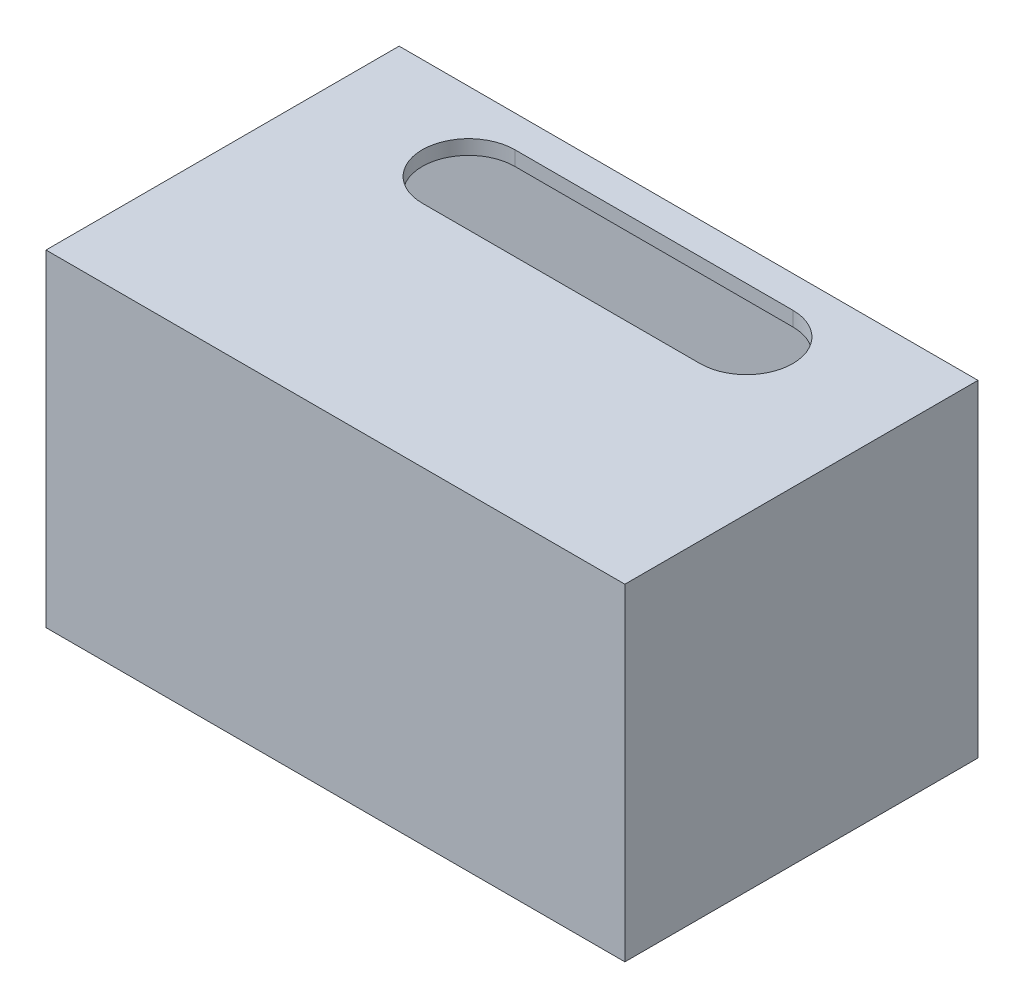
SolidWorks part; units mm, degrees
ref_plane "Front Plane" through (0, 0, 0) normal (0, 0, 1) x (1, 0, 0)
ref_plane "Top Plane" through (0, 0, 0) normal (0, 1, 0) x (1, 0, 0)
ref_plane "Right Plane" through (0, 0, 0) normal (1, 0, 0) x (0, 0, -1)
sketch "Sketch1" plane through (0, 0, 0) normal (0, 1, 0) x (1, 0, 0)
  line L1 (0, 0) -> (63.5, 0)
  line L2 (0, 0) -> (0, 38.735)
  line L3 (0, 38.735) -> (63.5, 38.735)
  line L4 (63.5, 0) -> (63.5, 38.735)
  dimension "D1" = 38.735
  dimension "D2" = 63.5
extrude "Extrude1" add sketch "Sketch1" along normal blind 4.7625
sketch "Sketch2" plane through (0, 4.7625, 0) normal (0, 1, 0) x (1, 0, 0)
  line L1 (0, 38.735) -> (63.5, 38.735)
  line L2 (0, 38.735) -> (0, 0)
  line L3 (0, 0) -> (63.5, 0)
  line L4 (63.5, 38.735) -> (63.5, 0)
extrude "Extrude-Thin1" add sketch "Sketch2" along normal blind 29.5275 thin
sketch "Sketch3" plane through (0, 34.29, 0) normal (0, 1, 0) x (1, 0, 0)
  line L1 (63.5, 38.735) -> (0, 38.735)
  line L2 (63.5, 38.735) -> (63.5, 0)
  line L3 (63.5, 0) -> (0, 0)
  line L4 (0, 38.735) -> (0, 0)
  line L5 (16.1925, 35.2425) -> (46.6725, 35.2425)
  line L6 (46.6725, 25.0825) -> (16.1925, 25.0825)
  line L7 (61.9125, 1.5875) -> (61.9125, 37.1475) construction
  line L8 (61.9125, 37.1475) -> (1.5875, 37.1475) construction
  arc A0 (46.6725, 25.0825) -> (46.6725, 35.2425) centre (46.6725, 30.1625) ccw
  arc A1 (16.1925, 35.2425) -> (16.1925, 25.0825) centre (16.1925, 30.1625) ccw
  point P16 (51.7525, 30.1625)
  point P17 (11.1125, 30.1625)
  dimension "D1" = 10.16
  dimension "D2" = 1.905
  dimension "D3" = 40.64
  dimension "D4" = 10.16
extrude "Extrude2" add sketch "Sketch3" along normal blind 1.5875
hole_wizard "#8-32 Tapped Hole1" positions "Sketch5" profile "Sketch4" tap size "#8-32" standard "Ansi Inch"
sketch "Sketch5" plane through (0, 0, 0) normal (-1, 0, 0) x (0, 0, 1)
  line L2 (3.5746, 4.7625) -> (-36.0144, 4.7625) construction
  line L4 (-38.735, 0) -> (0, 0) construction
  line L5 (-29.21, 2.3812) -> (-29.21, 4.7625) construction
  line L10 (-29.21, 2.3812) -> (-29.21, 0) construction
  line L17 (-38.735, 35.8775) -> (-38.735, 0) construction
  point P0 (-29.21, 2.3812)
  dimension "D1" = 4.7625
  dimension "D2" = 9.525
sketch "Sketch4" plane through (0, 2.3812, -29.21) normal (0, 1, 0) x (0, 0, 1)
  line L0 (0, 0) -> (0, 13.4838)
  line L1 (0, 13.4838) -> (1.7272, 12.446)
  line L2 (1.7272, 12.446) -> (1.7272, 0)
  line L5 (1.7272, 0) -> (0, 0)
  line L10 (0, 13.4838) -> (-1.7272, 12.446) construction
  line L11 (0, -6.35) -> (0, 107.95) construction
  dimension "Tap Drill Dia." = 3.4544
  dimension "Tap Drill Depth" = 12.446
  dimension "Drill Angle" = 118
